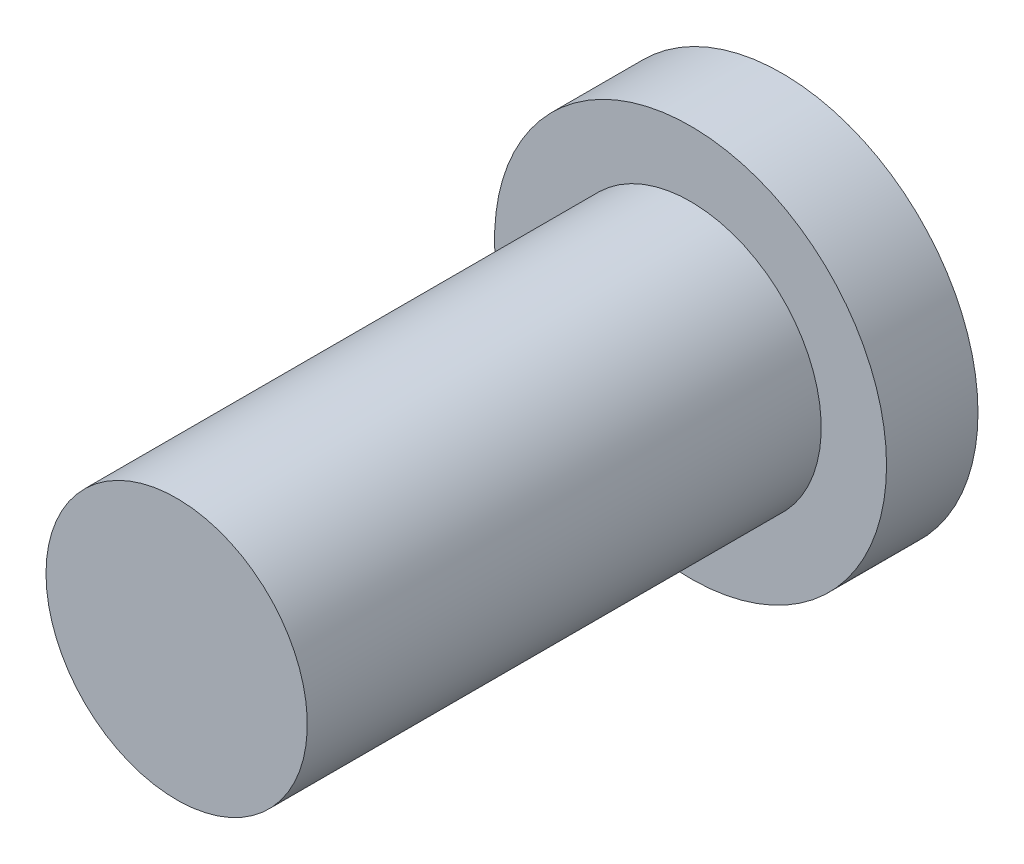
SolidWorks part; units mm, degrees
ref_plane "Plane1" through (0, 0, 0) normal (0, 0, 1) x (1, 0, 0)
ref_plane "Plane2" through (0, 0, 0) normal (0, 1, 0) x (1, 0, 0)
ref_plane "Plane3" through (0, 0, 0) normal (1, 0, 0) x (0, 0, -1)
sketch "Sketch1" plane through (0, 0, 0) normal (0, 0, 1) x (1, 0, 0)
  circle A0 centre (0, 0) radius 1.143
  dimension "D1" = 2.286
extrude "Base-Extrude" add sketch "Sketch1" along normal blind 0.5334
sketch "Sketch2" plane through (0, 0, 0.5334) normal (0, 0, 1) x (1, 0, 0)
  circle A0 centre (0, 0) radius 0.762
  dimension "D1" = 1.524
extrude "Boss-Extrude1" add sketch "Sketch2" along normal blind 2.9972
sketch "Sketch3" plane through (0, 0, 0) normal (0, 0, -1) x (-1, 0, 0)
  line L0 (0.1905, -0.1905) -> (0.5715, -0.1905)
  line L1 (-0.5715, 0.1905) -> (-0.1905, 0.1905)
  line L2 (-0.5715, 0.1905) -> (-0.5715, -0.1905)
  line L3 (-0.5715, -0.1905) -> (-0.1905, -0.1905)
  line L4 (0.5715, 0.1905) -> (0.5715, -0.1905)
  line L5 (-0.1905, 0.5715) -> (0.1905, 0.5715)
  line L6 (-0.1905, 0.5715) -> (-0.1905, 0.1905)
  line L7 (-0.1905, -0.5715) -> (0.1905, -0.5715)
  line L8 (0.1905, 0.5715) -> (0.1905, 0.1905)
  line L9 (-0.1905, -0.1905) -> (-0.1905, -0.5715)
  line L10 (0.1905, -0.1905) -> (0.1905, -0.5715)
  line L11 (0.1905, 0.1905) -> (0.5715, 0.1905)
  dimension "D1" = 1.143
  dimension "D2" = 1.143
  dimension "D3" = 0.5715
  dimension "D4" = 0.5715
  dimension "D5" = 0.381
  dimension "D6" = 0.381
  dimension "D7" = 0.1905
  dimension "D8" = 0.1905
extrude "Cut-Extrude1" cut sketch "Sketch3" against normal blind 0.381
